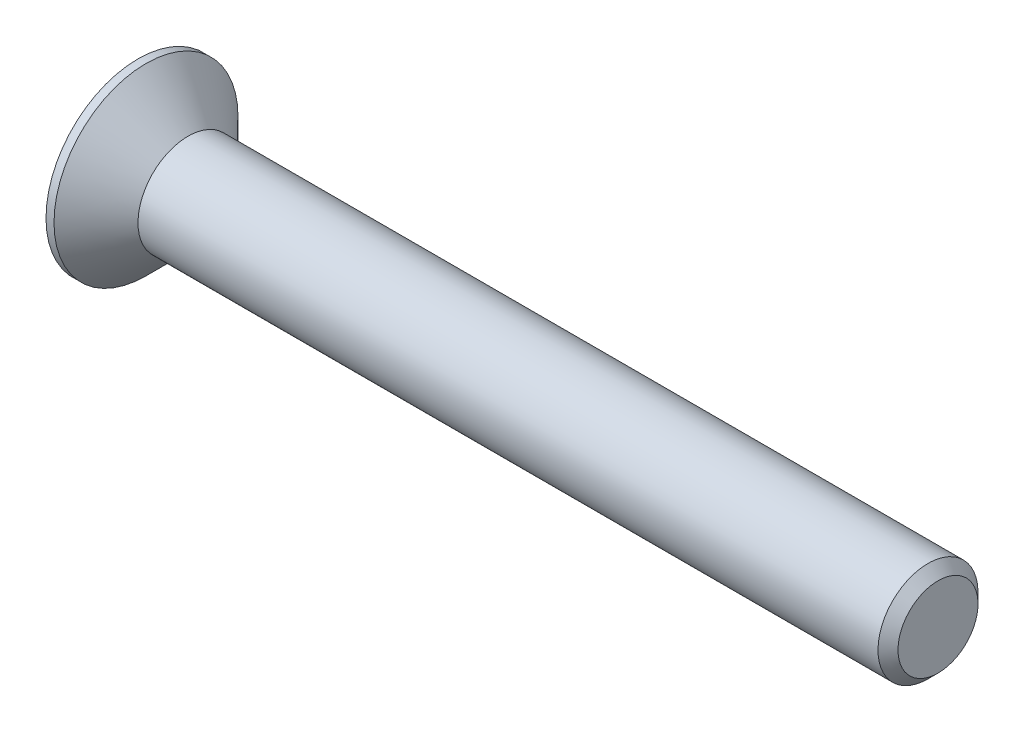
SolidWorks part; units mm, degrees
ref_plane "Front Plane" through (0, 0, 0) normal (0, 0, 1) x (1, 0, 0)
ref_plane "Top Plane" through (0, 0, 0) normal (0, 1, 0) x (1, 0, 0)
ref_plane "Right Plane" through (0, 0, 0) normal (1, 0, 0) x (0, 0, -1)
sketch "Sketch1" plane through (0, 0, 0) normal (0, 0, 1) x (1, 0, 0)
  line L1 (-2.5, 4.6) -> (-2.5, 0)
  line L2 (-2.5, 0) -> (37.5, 0)
  line L3 (37.5, 0) -> (37.5, 2.5)
  line L4 (37.5, 2.5) -> (0, 2.5)
  line L5 (-2.5, 4.6) -> (-2.1, 4.6)
  line L6 (-2.1, 4.6) -> (0, 2.5)
  dimension "D1" = 2.5
  dimension "D2" = 45
  dimension "D3" = 2.5
  dimension "D4" = 40
  dimension "D5" = 4.6
revolve "Revolve1" add sketch "Sketch1" angle 360 about L2
chamfer "Chamfer1" distance 0.5 angle 45 1 edges at (37.5, -2.5, 0)
sketch "Sketch2" plane through (-2.5, 0, 0) normal (-1, 0, 0) x (0, 0, 1)
  line L0 (-0.575, 2.3) -> (0.575, 2.3)
  line L1 (0.575, 2.3) -> (0.575, 0.575)
  line L2 (0.575, 0.575) -> (2.3, 0.575)
  line L3 (2.3, 0.575) -> (2.3, -0.575)
  line L4 (2.3, -0.575) -> (0.575, -0.575)
  line L5 (0.575, -0.575) -> (0.575, -2.3)
  line L6 (0.575, -2.3) -> (-0.575, -2.3)
  line L7 (-0.575, -2.3) -> (-0.575, -0.575)
  line L8 (-0.575, -0.575) -> (-2.3, -0.575)
  line L9 (-2.3, -0.575) -> (-2.3, 0.575)
  line L10 (-2.3, 0.575) -> (-0.575, 0.575)
  line L11 (-0.575, 0.575) -> (-0.575, 2.3)
  point P2 (0, 2.3)
  point P14 (0, -2.3)
  point P15 (2.3, 0)
  point P16 (-2.3, 0)
  dimension "D1" = 4.6
  dimension "D2" = 1.15
extrude "Cut-Extrude1" cut sketch "Sketch2" against normal blind 2.1
